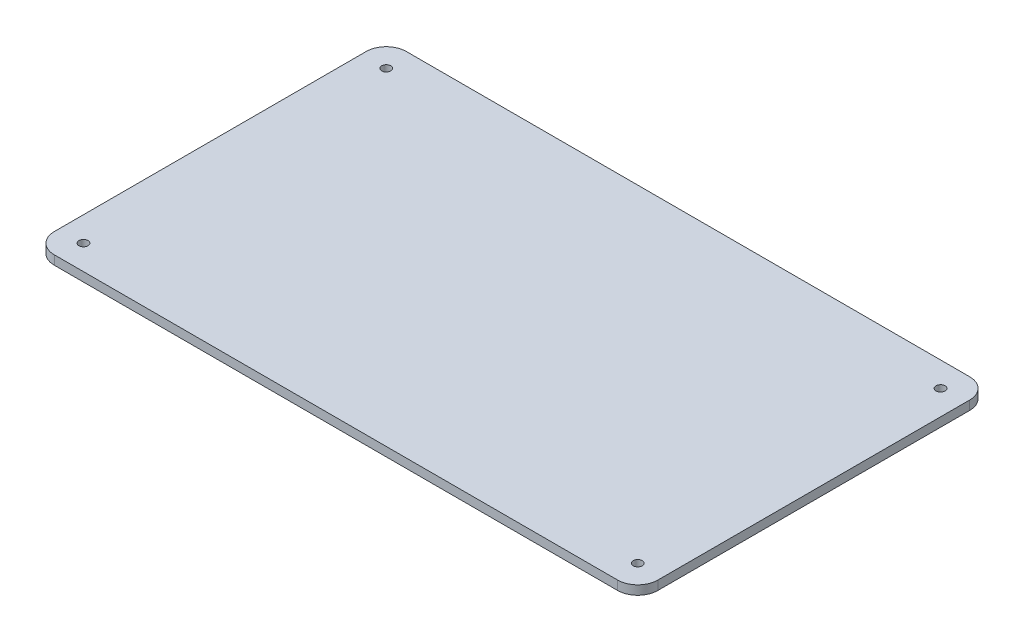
SolidWorks part; units mm, degrees
ref_plane "Front Plane" through (0, 0, 0) normal (0, 0, 1) x (1, 0, 0)
ref_plane "Top Plane" through (0, 0, 0) normal (0, 1, 0) x (1, 0, 0)
ref_plane "Right Plane" through (0, 0, 0) normal (1, 0, 0) x (0, 0, -1)
sketch "Sketch1" plane through (0, 0, 0) normal (0, 1, 0) x (1, 0, 0)
  line L0 (-150, 0) -> (150, 0) construction
  line L1 (140, -87.5) -> (-140, -87.5)
  line L2 (150, -77.5) -> (150, 77.5)
  line L3 (140, 87.5) -> (-140, 87.5)
  line L4 (-150, -77.5) -> (-150, 77.5)
  line L5 (150, -87.5) -> (-150, 87.5) construction
  line L6 (150, 87.5) -> (-150, -87.5) construction
  arc A9 (140, -87.5) -> (150, -77.5) centre (140, -77.5) ccw
  arc A10 (150, 77.5) -> (140, 87.5) centre (140, 77.5) ccw
  arc A11 (-140, -87.5) -> (-150, -77.5) centre (-140, -77.5) cw
  arc A12 (-140, 87.5) -> (-150, 77.5) centre (-140, 77.5) ccw
  dimension "D16" = 10
  dimension "D1" = 300
  dimension "D2" = 175
extrude "Boss-Extrude1" add sketch "Sketch1" along normal blind 4.5
hole_wizard "M4 Clearance Hole1" positions "Sketch2" profile "Sketch3" hole size "M4" standard "ANSI Metric"
sketch "Sketch2" plane through (0, 4.5, 0) normal (0, 1, 0) x (1, 0, 0)
  line L0 (-150, 77.5) -> (-150, -77.5) construction
  line L1 (140, 87.5) -> (-140, 87.5) construction
  line L2 (150, -77.5) -> (150, 77.5) construction
  line L3 (-140, -87.5) -> (140, -87.5) construction
  point P0 (-137.75, 75.25)
  point P2 (137.75, 75.25)
  point P4 (137.75, -75.25)
  point P6 (-137.75, -75.25)
  point P10 (0, 0)
  point P11 (0, 0)
  point P12 (0, 0)
  point P13 (0, 0)
  point P14 (0, 0)
  dimension "D1" = 12.25
  dimension "D2" = 12.25
  dimension "D3" = 12.25
  dimension "D4" = 12.25
sketch "Sketch3" plane through (-137.75, 4.5, -75.25) normal (1, 0, 0) x (0, 0, 1)
  line L0 (0, 0) -> (0, 4.5)
  line L1 (0, 4.5) -> (2.25, 4.5)
  line L2 (2.25, 4.5) -> (2.25, 0)
  line L5 (2.25, 0) -> (0, 0)
  line L11 (0, -6.35) -> (0, 107.95) construction
  dimension "Thru Hole Dia." = 4.5
  dimension "Thru Hole Depth" = 4.5
